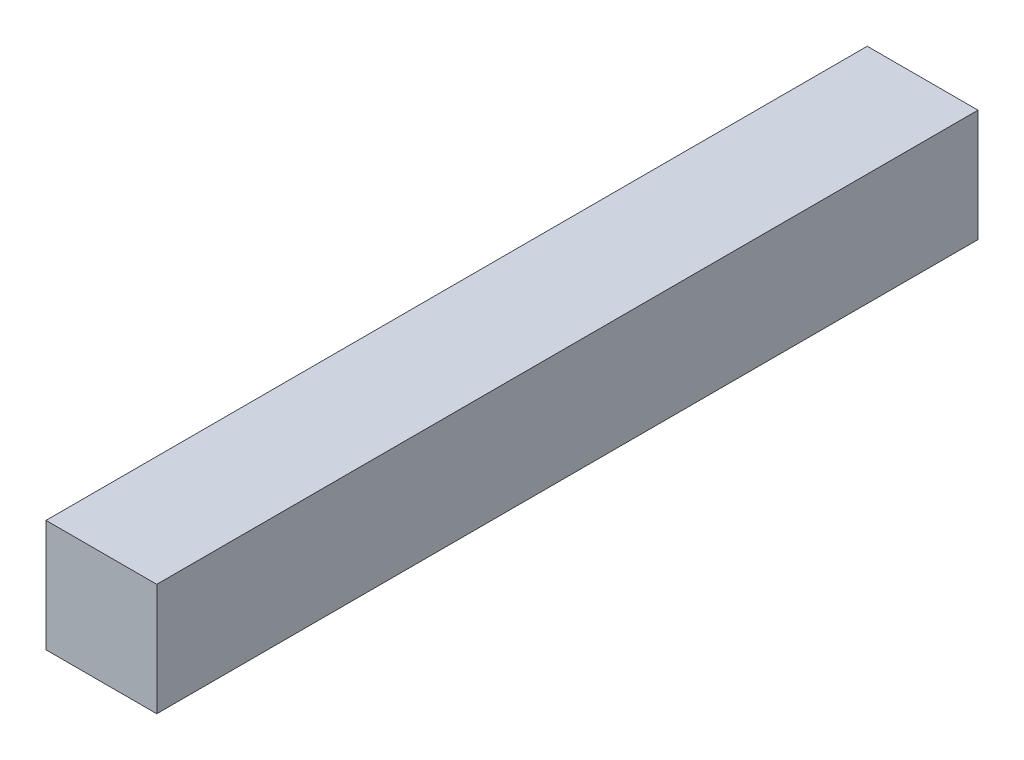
SolidWorks part; units mm, degrees
ref_plane "Front Plane" through (0, 0, 0) normal (0, 0, 1) x (1, 0, 0)
ref_plane "Top Plane" through (0, 0, 0) normal (0, 1, 0) x (1, 0, 0)
ref_plane "Right Plane" through (0, 0, 0) normal (1, 0, 0) x (0, 0, -1)
sketch "Sketch1" plane through (0, 0, 0) normal (0, 0, 1) x (1, 0, 0)
  line L1 (-2.9972, -3.0341) -> (2.9972, -3.0341)
  line L2 (-2.9972, -3.0341) -> (-2.9972, 3.0341)
  line L3 (-2.9972, 3.0341) -> (2.9972, 3.0341)
  line L4 (2.9972, -3.0341) -> (2.9972, 3.0341)
  line L5 (-2.9972, -3.0341) -> (2.9972, 3.0341) construction
  line L6 (-2.9972, 3.0341) -> (2.9972, -3.0341) construction
  point P0 (0, 0)
  dimension "D1" = 5.9944
  dimension "D2" = 6.0681
extrude "Boss-Extrude1" add sketch "Sketch1" along normal blind 44.45
